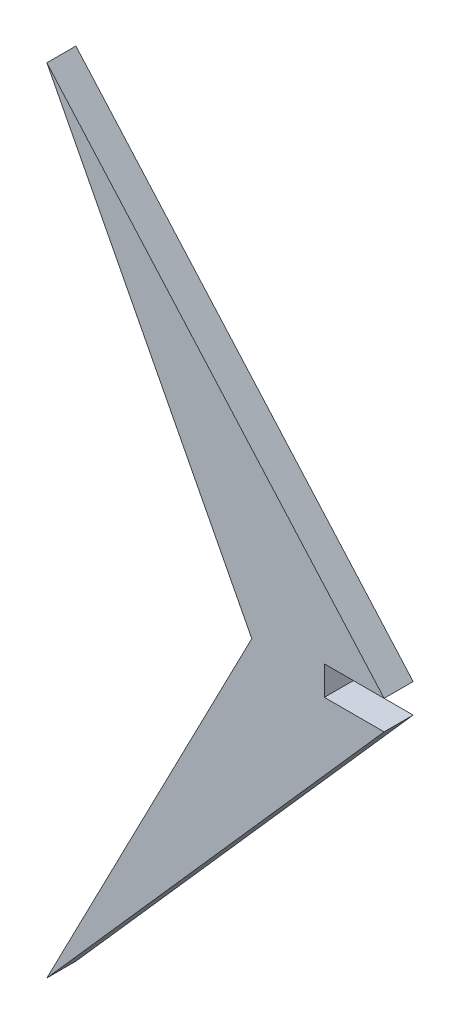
SolidWorks part; units mm, degrees
ref_plane "Спереди" through (0, 0, 0) normal (0, 0, 1) x (1, 0, 0)
ref_plane "Сверху" through (0, 0, 0) normal (0, 1, 0) x (1, 0, 0)
ref_plane "Справа" through (0, 0, 0) normal (1, 0, 0) x (0, 0, -1)
sketch "Model" plane through (0, 0, 0) normal (0, 0, 1) x (1, 0, 0)
  line L0 (142.6424, 181.9152) -> (185, 100)
  line L1 (185, 100) -> (142.6424, 18.0848)
  line L2 (200, 97) -> (200, 103)
  line L3 (200, 97) -> (212.35, 97)
  line L4 (200, 103) -> (212.35, 103)
  line L5 (212.35, 103) -> (142.6424, 181.9152)
  line L6 (142.6424, 18.0848) -> (212.35, 97)
extrude "Бобышка-Вытянуть1" add sketch "Model" along normal blind 6
